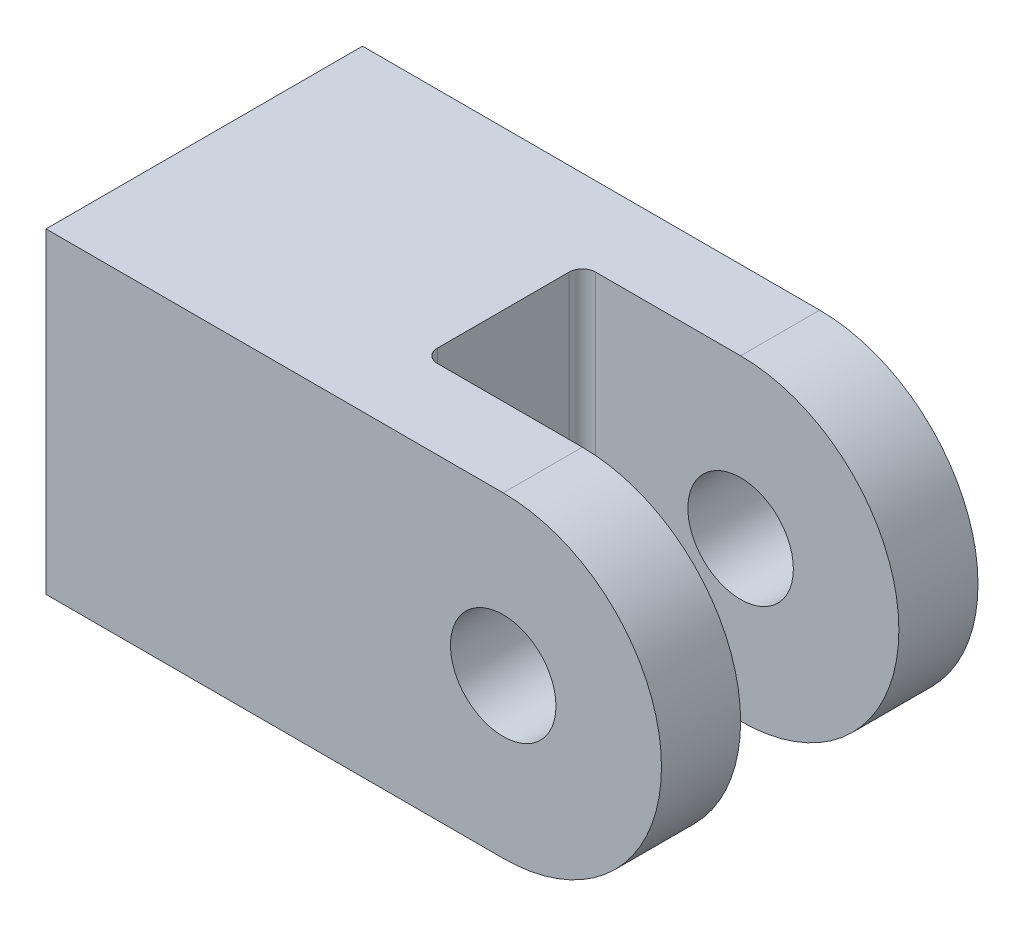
SolidWorks part; units mm, degrees
ref_plane "Front Plane" through (0, 0, 0) normal (0, 0, 1) x (1, 0, 0)
ref_plane "Top Plane" through (0, 0, 0) normal (0, 1, 0) x (1, 0, 0)
ref_plane "Right Plane" through (0, 0, 0) normal (1, 0, 0) x (0, 0, -1)
sketch "Sketch1" plane through (0, 0, 0) normal (0, 0, 1) x (1, 0, 0)
  line L0 (0, 0) -> (52, 0)
  line L1 (0, 0) -> (0, 36)
  line L2 (0, 36) -> (52, 36)
  line L4 (52, 0) -> (52, 0.3881)
  arc A0 (52, 0) -> (52, 36) centre (52, 18) ccw
  dimension "D1" = 36
  dimension "D2" = 52
extrude "Clevis Body Extrude1" add sketch "Sketch1" along normal mid plane 36 contours L0 L1 L2 A0
sketch "Sketch2" plane through (0, 0, 0) normal (0, 0, 1) x (1, 0, 0)
  line L0 (0, 0) -> (0, 36) construction
  line L1 (0, 0) -> (52, 0) construction
  circle A0 centre (52, 18) radius 6
  dimension "D2" = 18
  dimension "D3" = 12
  dimension "D1" = 52
extrude "Pin Holes Cut-Extrude1" cut sketch "Sketch2" against normal mid plane 36
sketch "Sketch3" plane through (0, 0, 0) normal (-1, 0, 0) x (0, 0, 1)
  line L0 (18, 12) -> (18, 24) construction
  line L1 (18, 0) -> (-18, 0) construction
  circle A0 centre (0, 18) radius 7.5
  dimension "D3" = 15
  dimension "D1" = 18
  dimension "D2" = 18
extrude "Threaded Hole Cut-Extrude2" cut sketch "Sketch3" against normal blind 25
sketch "Sketch5" plane through (0, 0, 0) normal (0, 1, 0) x (1, 0, 0)
  line L0 (0, -18) -> (52, -18) construction
  line L1 (34, -9) -> (72, -9)
  line L2 (34, -9) -> (34, 9)
  line L3 (34, 9) -> (72, 9)
  line L4 (72, -9) -> (72, 9)
  dimension "D1" = 18
  dimension "D2" = 34
  dimension "D3" = 9
  dimension "D4" = 38
extrude "Clivis Gap Cut-Extrude4" cut sketch "Sketch5" along normal through all
fillet "Fillet2" radius 1.5 2 edges at (34, 18, -9) (34, 18, 9)
chamfer "Chamfer2" distance 0.5 angle 45 1 edges at (0, 18, 7.5)
